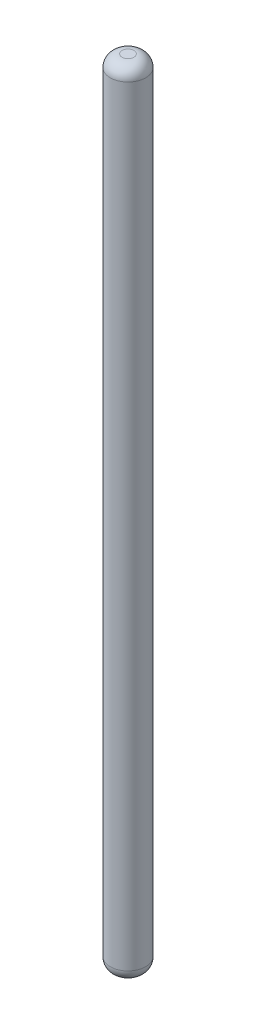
SolidWorks part; units mm, degrees
ref_plane "Front Plane" through (0, 0, 0) normal (0, 0, 1) x (1, 0, 0)
ref_plane "Top Plane" through (0, 0, 0) normal (0, 1, 0) x (1, 0, 0)
ref_plane "Right Plane" through (0, 0, 0) normal (1, 0, 0) x (0, 0, -1)
sketch "Sketch1" plane through (0, 0, 0) normal (0, 1, 0) x (1, 0, 0)
  circle A0 centre (0, 0) radius 1.5
  dimension "D1" = 3
extrude "Boss-Extrude1" add sketch "Sketch1" along normal blind 67
fillet "Fillet1" radius 1 2 edges at (0, 0, 1.5) (0, 67, 1.5)
